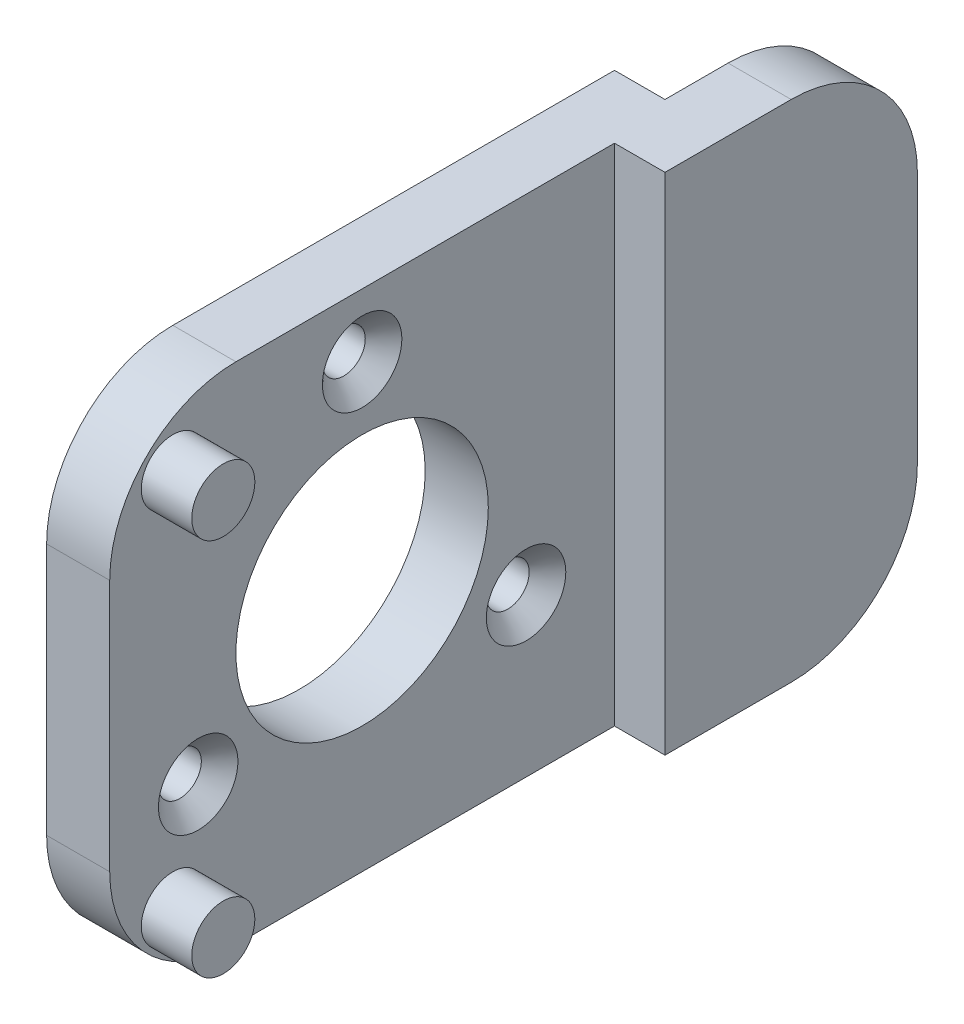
SolidWorks part; units mm, degrees
ref_plane "Ön Düzlem" through (0, 0, 0) normal (0, 0, 1) x (1, 0, 0)
ref_plane "Üst Düzlem" through (0, 0, 0) normal (0, 1, 0) x (1, 0, 0)
ref_plane "Sağ Düzlem" through (0, 0, 0) normal (1, 0, 0) x (0, 0, -1)
sketch "Sketch1" plane through (0, 0, 0) normal (1, 0, 0) x (0, 0, -1)
  line L0 (10, 20) -> (20, 20)
  line L1 (-10, 20) -> (10, 20)
  line L2 (-20, 10) -> (-20, -10)
  line L3 (-10, -20) -> (10, -20)
  line L4 (20, 10) -> (20, -10)
  line L5 (-20, 20) -> (20, -20) construction
  line L6 (-20, -20) -> (20, 20) construction
  line L7 (20, 20) -> (20, 10)
  line L8 (20, -10) -> (20, -20)
  line L9 (20, -20) -> (10, -20)
  circle A0 centre (0, 0) radius 10
  arc A1 (-20, -10) -> (-10, -20) centre (-10, -10) ccw
  arc A4 (-10, 20) -> (-20, 10) centre (-10, 10) ccw
  dimension "D1" = 40
  dimension "D3" = 10
  dimension "D2" = 40
extrude "Boss-Extrude1" add sketch "Sketch1" along normal blind 5
hole_wizard "CSK for M3 Flat Head Machine Screw1" positions "Sketch3" profile "Sketch2" countersink size "M3" standard "ANSI Metric"
sketch "Sketch3" plane through (5, 0, 0) normal (1, 0, 0) x (0, 0, -1)
  point P0 (0, 15)
  point P3 (12.9904, -7.5)
  point P6 (-12.9904, -7.5)
sketch "Sketch2" plane through (5, 15, 0) normal (0, 1, 0) x (0, 0, -1)
  line L0 (0, 0) -> (0, 5)
  line L1 (0, 5) -> (1.7, 5)
  line L2 (1.7, 5) -> (1.7, 1.45)
  line L3 (1.7, 1.45) -> (3.15, 0)
  line L5 (3.15, 0) -> (0, 0)
  line L6 (-1.7, 1.45) -> (-3.15, 0) construction
  line L11 (0, -6.35) -> (0, 107.95) construction
  dimension "Thru Hole Dia." = 3.4
  dimension "Thru Hole Depth" = 5
  dimension "Near C'Sink Dia." = 6.3
  dimension "Near C'Sink Angle" = 90
sketch "Sketch4" plane through (0, 0, 0) normal (-1, 0, 0) x (0, 0, 1)
  line L1 (-20, -20) -> (-25, -20)
  line L2 (-20, -20) -> (-20, 20)
  line L3 (-20, 20) -> (-25, 20)
  line L4 (-25, -20) -> (-25, 20)
  dimension "D1" = 40
  dimension "D2" = 5
extrude "Boss-Extrude2" add sketch "Sketch4" against normal blind 9
sketch "Sketch5" plane through (0, 0, -25) normal (0, 0, -1) x (-1, 0, 0)
  line L0 (-9, 20) -> (0, 20) construction
  line L1 (-9, -20) -> (-4, -20)
  line L2 (-9, -20) -> (-9, 20)
  line L3 (-9, 20) -> (-4, 20)
  line L4 (-4, -20) -> (-4, 20)
  dimension "D1" = 5
extrude "Boss-Extrude3" add sketch "Sketch5" along normal blind 15
fillet "Fillet2" radius 10 2 edges at (6.5, 20, -40) (6.5, -20, -40)
sketch "Sketch6" plane through (5, 0, 0) normal (1, 0, 0) x (0, 0, -1)
  line L0 (-10, -20) -> (20, -20) construction
  line L2 (-20, 10) -> (-20, -10) construction
  line L3 (-20, 10) -> (-20, -10) construction
  line L4 (20, 20) -> (-10, 20) construction
  circle A0 centre (-15, -15) radius 2.5
  circle A1 centre (-15, 15) radius 2.5
  point P8 (-20, -7.8763)
  point P9 (-14.7168, -22.8529)
  dimension "D1" = 5
  dimension "D2" = 5
  dimension "D3" = 5
  dimension "D4" = 5
extrude "Boss-Extrude4" add sketch "Sketch6" along normal blind 4
